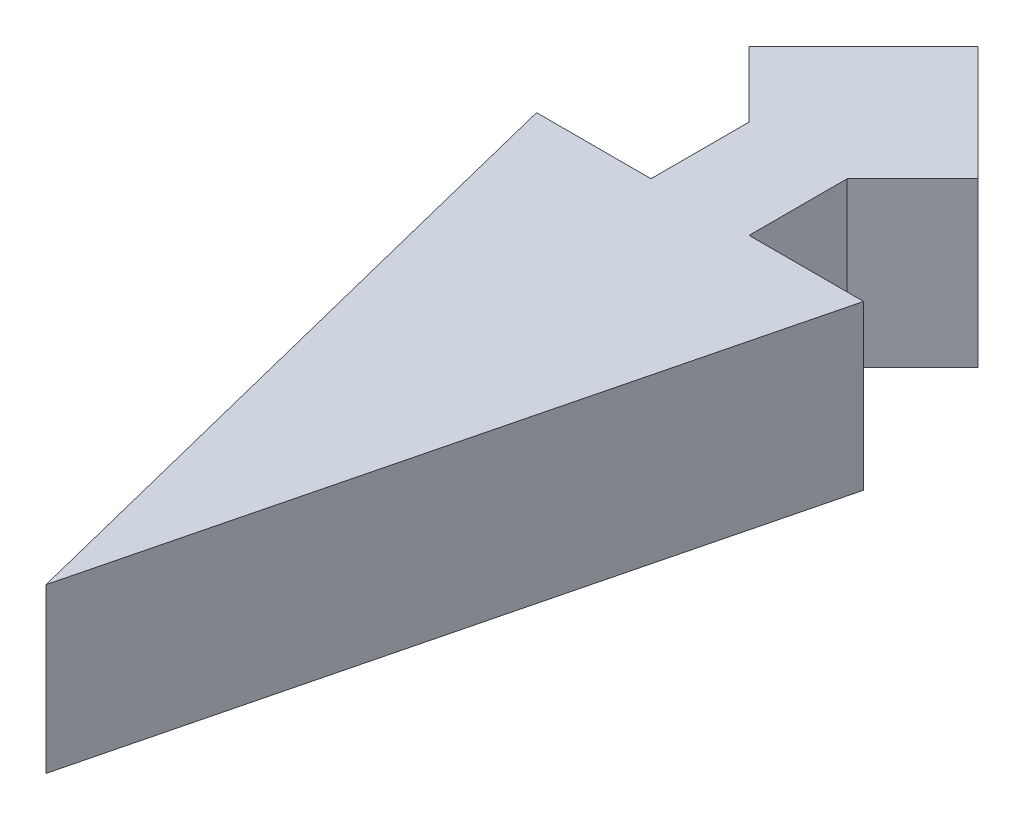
SolidWorks part; units mm, degrees
ref_plane "Front Plane" through (0, 0, 0) normal (0, 0, 1) x (1, 0, 0)
ref_plane "Top Plane" through (0, 0, 0) normal (0, 1, 0) x (1, 0, 0)
ref_plane "Right Plane" through (0, 0, 0) normal (1, 0, 0) x (0, 0, -1)
sketch "Sketch2" plane through (0, 0, 0) normal (0, 1, 0) x (1, 0, 0)
  line L6 (-1.5, -8.5) -> (-5, -8.5)
  line L7 (-5, -8.5) -> (0, -28.5)
  line L12 (-1.5, -8.5) -> (-1.5, -5.5)
  line L13 (0, 0) -> (0, -28.5) construction
  line L18 (3.5, -3.5) -> (0, 0)
  line L19 (-1.5, -5.5) -> (-3.5, -3.5)
  line L20 (-3.5, -3.5) -> (0, 0)
  line L21 (1.5, -5.5) -> (3.5, -3.5)
  line L22 (1.5, -8.5) -> (1.5, -5.5)
  line L23 (5, -8.5) -> (0, -28.5)
  line L24 (1.5, -8.5) -> (5, -8.5)
  dimension "D1" = 3
  dimension "D2" = 7
  dimension "D4" = 3
  dimension "Width" = 10
  dimension "Length" = 20
  dimension "D6" = 45
extrude "Body" add sketch "Sketch2" along normal mid plane 4
